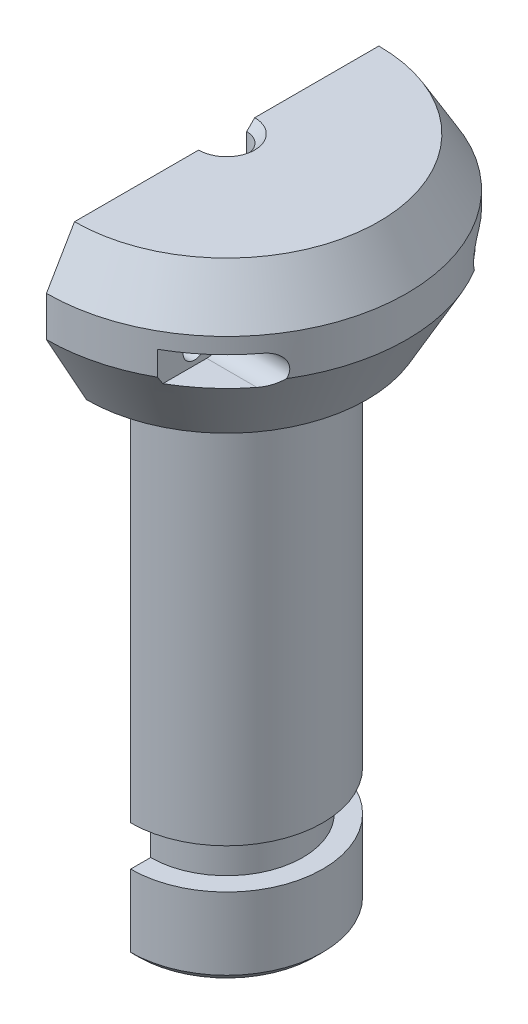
SolidWorks part; units mm, degrees
ref_plane "Plan de face" through (0, 0, 0) normal (0, 0, 1) x (1, 0, 0)
ref_plane "Plan de dessus" through (0, 0, 0) normal (0, 1, 0) x (1, 0, 0)
ref_plane "Plan de droite" through (0, 0, 0) normal (1, 0, 0) x (0, 0, -1)
sketch "Esquisse1" plane through (0, 0, 0) normal (0, 1, 0) x (1, 0, 0)
  circle A0 centre (0, 0) radius 45
  circle A1 centre (0, 0) radius 5
  dimension "D1" = 90
  dimension "D2" = 10
extrude "Boss.-Extru.1" add sketch "Esquisse1" along normal blind 40
sketch "Esquisse2" plane through (0, 40, 0) normal (0, 1, 0) x (-1, 0, 0)
  line L0 (0, -45) -> (0, 45)
  circle A0 centre (0, 0) radius 45 construction
  circle A1 centre (0, 0) radius 45 construction
  arc A2 (0, -45) -> (0, 45) centre (0, 0) ccw
extrude "Enlèv. mat.-Extru.1" cut sketch "Esquisse2" against normal through all
chamfer "Chanfrein1" distance 12 distance2 7 1 edges at (45, 40, 0)
chamfer "Chanfrein4" distance 10 distance2 18 1 edges at (45, 0, 0)
sketch "Esquisse3" plane through (0, 0, 0) normal (0, -1, 0) x (1, 0, 0)
  line L0 (0, -5) -> (0, -24)
  line L1 (0, -5) -> (0, -35) construction
  line L2 (0, 5) -> (0, 24)
  line L3 (0, 35) -> (0, 5) construction
  arc A0 (0, -5) -> (0, 5) centre (0, 0) ccw
  arc A1 (0, -24) -> (0, 24) centre (0, 0) ccw
  dimension "D3" = 0
  dimension "D4" = 5
  dimension "D1" = 24
  dimension "D2" = 24
extrude "Boss.-Extru.2" add sketch "Esquisse3" along normal blind 127
ref_plane "Plan1" through (40, 0, 0) normal (1, 0, 0) x (0, 0, -1)
sketch "Esquisse5" plane through (40, 0, 0) normal (1, 0, 0) x (0, 0, -1)
  line L0 (45, 18) -> (45, 28) construction
  line L1 (-27, 24.05) -> (-47, 24.05)
  line L2 (-27, 15.95) -> (-47, 15.95)
  line L3 (-47, 15.95) -> (-47, 24.05)
  line L4 (38, 40) -> (-38, 40) construction
  line L5 (27, 24.05) -> (47, 24.05)
  line L6 (-38, 40) -> (-5, 40) construction
  line L7 (-45, 18) -> (-45, 28) construction
  line L8 (27, 15.95) -> (47, 15.95)
  line L9 (47, 15.95) -> (47, 24.05)
  arc A0 (-27, 15.95) -> (-27, 24.05) centre (-27, 20) ccw
  arc A1 (27, 24.05) -> (27, 15.95) centre (27, 20) ccw
  dimension "D1" = 18
  dimension "D2" = 20
  dimension "D3" = 8.1
  dimension "D4" = 8.1
  dimension "D5" = 20
  dimension "D6" = 18
  dimension "D8" = 20
  dimension "D7" = 20
extrude "Enlèv. mat.-Extru.4" cut sketch "Esquisse5" against normal blind 18
chamfer "Chanfrein2" distance 2 angle 45 2 edges at (5, 40, 0) (5, -127, 0)
sketch "Esquisse6" plane through (22, 0, 0) normal (1, 0, 0) x (0, 0, -1)
  line L0 (45, 18) -> (45, 28) construction
  line L1 (-45, 18) -> (-45, 28) construction
  line L2 (38, 40) -> (-38, 40) construction
  circle A0 centre (-30, 20) radius 2.9
  circle A1 centre (30, 20) radius 2.9
  dimension "D1" = 15
  dimension "D2" = 15
  dimension "D3" = 20
  dimension "D4" = 20
  dimension "D5" = 5.8
  dimension "D6" = 5.8
extrude "Enlèv. mat.-Extru.5" cut sketch "Esquisse6" against normal through all
sketch "Esquisse7" plane through (0, 0, 0) normal (-1, 0, 0) x (0, 0, 1)
  line L0 (24, -127) -> (24, 0) construction
  line L5 (24, -127) -> (7, -127) construction
  line L6 (19, -97) -> (24, -97)
  line L7 (19, -97) -> (19, -107)
  line L8 (19, -107) -> (24, -107)
  line L9 (24, -97) -> (24, -107)
  line L11 (0, 55.4217) -> (0, -130.0123) construction
  dimension "D1" = 20
  dimension "D2" = 10
  dimension "D6" = 5
revolve "Enlèvement de matière-Révolution1" cut sketch "Esquisse7" angle 180 about L11
chamfer "Chanfrein3" distance 2 angle 45 1 edges at (24, -127, 0)
